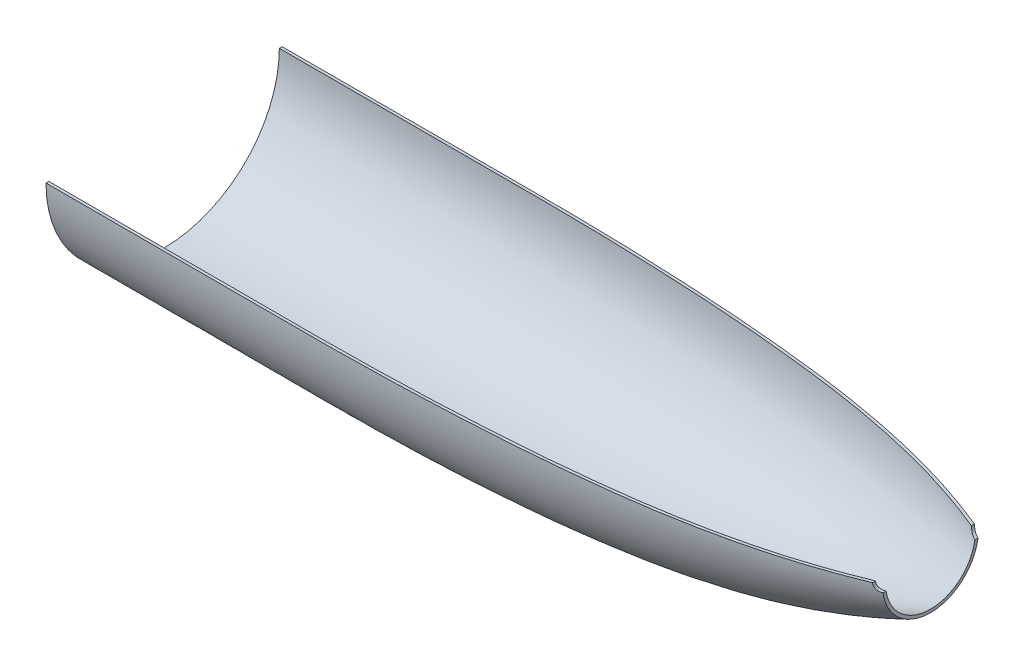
SolidWorks part; units mm, degrees
other "<0 SERIES 58 EXTENDED SHELL>-<Form Shell>"
ref_plane "FRONT" through (0, 0, 0) normal (0, 0, 1) x (1, 0, 0)
ref_plane "TOP" through (0, 0, 0) normal (0, 1, 0) x (1, 0, 0)
ref_plane "SIDE" through (0, 0, 0) normal (1, 0, 0) x (0, 0, -1)
inserted part "0 SERIES 58 EXTENDED SHELL"
ref_plane "AFT TRIM 47 inches" through (-101.6, 0, 0) normal (1, 0, 0) x (0, 0, -1)
ref_plane "Aft Cut 47 Inch" [suppressed] through (-101.6, 0, 0) normal (1, 0, 0) x (0, 0, -1)
ref_plane "AFT Trim 59 Inches" through (-330.2, 0, 0) normal (1, 0, 0) x (0, 0, -1)
ref_plane "Aft Trim 68 Inches" through (-635, 0, 0) normal (1, 0, 0) x (0, 0, -1)
sketch "Sketch1" plane through (-635, 0, 0) normal (1, 0, 0) x (0, 0, -1)
  circle A0 centre (0, 0) radius 762
  dimension "D1" = 1524
extrude "PartingCut" cut sketch "Sketch1" against normal through all
sketch "Sketch2" plane through (-101.6, 0, 0) normal (1, 0, 0) x (0, 0, -1)
  circle A0 centre (0, 0) radius 101.6
  dimension "D1" = 203.2
extrude "TailCut" cut sketch "Sketch2" along normal through all
sketch "Sketch3" plane through (0, 0, 0) normal (0, 1, 0) x (1, 0, 0)
  line L0 (1096.3058, -101.6) -> (1096.3058, 101.6) construction
  line L1 (1096.3058, -131.5178) -> (1096.3058, 131.5178)
  line L2 (1096.3058, 131.5178) -> (1173.546, 131.5178)
  line L3 (1173.546, 131.5178) -> (1173.546, -131.5178)
  line L4 (1173.546, -131.5178) -> (1096.3058, -131.5178)
  line L5 (1112.188, 0) -> (1096.3058, 0) construction
  point P6 (1173.546, 0)
  dimension "D1" = 77.2402
  dimension "D2" = 263.0355
  dimension "D3" = 1096.3058
extrude "TrimPerpendicular" cut sketch "Sketch3" against normal through all
sketch "Sketch5" plane through (0, 0, 0) normal (0, 0, 1) x (1, 0, 0)
  line L0 (1096.3058, -108.5042) -> (1096.3058, 0) construction
  line L1 (1096.3058, 0) -> (-635, 0) construction
  arc A0 (1080.4308, 0) -> (1096.3058, -15.875) centre (1096.3058, 0) ccw
  dimension "D1" = 15.875
extrude "Cut-Extrude2" cut sketch "Sketch5" against normal through all and the other way through all
sketch "Sketch6" [suppressed] plane through (-101.6, 0, 0) normal (1, 0, 0) x (0, 0, -1)
  line L1 (-284.6615, 73.8593) -> (282.8655, 73.8593)
  line L2 (-284.6615, 73.8593) -> (-284.6615, -317.6624)
  line L3 (-284.6615, -317.6624) -> (282.8655, -317.6624)
  line L4 (282.8655, 73.8593) -> (282.8655, -317.6624)
extrude "Cut-Extrude3" [suppressed] cut sketch "Sketch6" against normal blind 2540
sketch "Sketch7" plane through (-330.2, 0, 0) normal (1, 0, 0) x (0, 0, -1)
  line L1 (-286.0084, 67.5734) -> (282.4165, 67.5734)
  line L2 (-286.0084, 67.5734) -> (-286.0084, -269.1712)
  line L3 (-286.0084, -269.1712) -> (282.4165, -269.1712)
  line L4 (282.4165, 67.5734) -> (282.4165, -269.1712)
extrude "Cut-Extrude4" [suppressed] cut sketch "Sketch7" against normal through all
